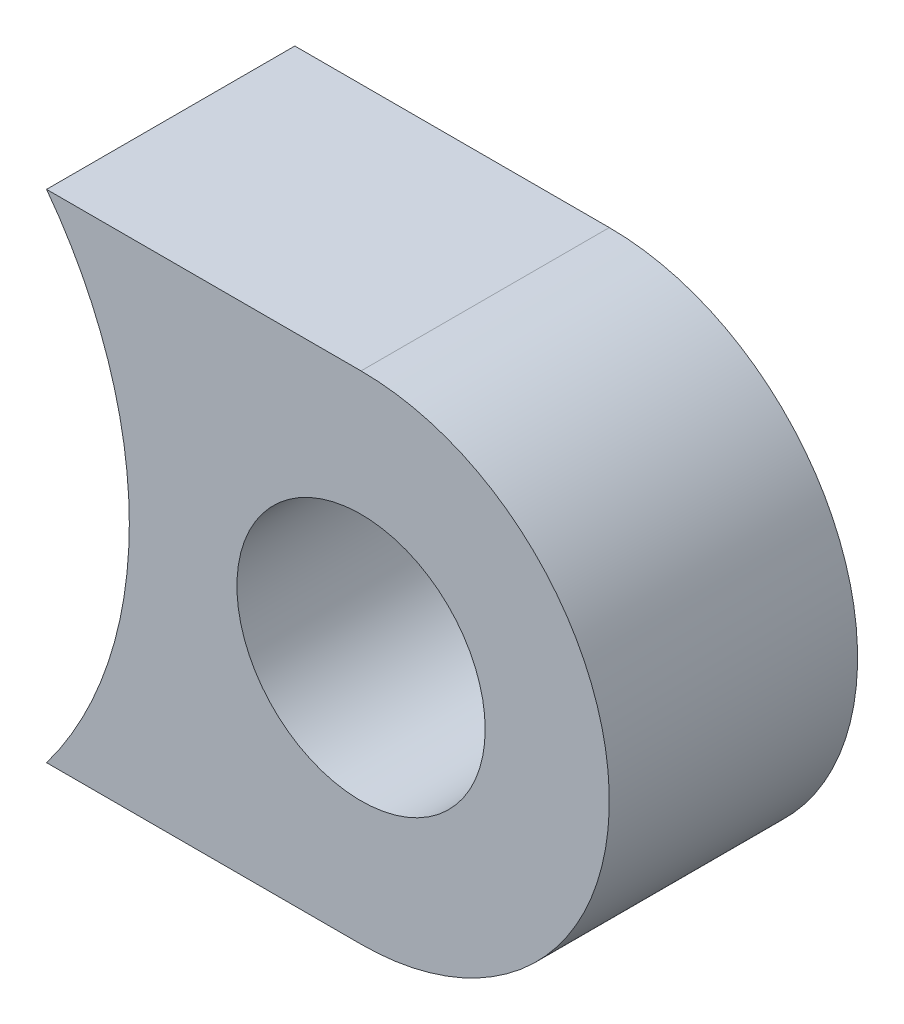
SolidWorks part; units mm, degrees
ref_plane "前视基准面" through (0, 0, 0) normal (0, 0, 1) x (1, 0, 0)
ref_plane "上视基准面" through (0, 0, 0) normal (0, 1, 0) x (1, 0, 0)
ref_plane "右视基准面" through (0, 0, 0) normal (1, 0, 0) x (0, 0, -1)
sketch "草图1" plane through (0, 0, 0) normal (0, 0, 1) x (1, 0, 0)
  line L0 (40, 30) -> (78, 30)
  line L1 (78, -30) -> (40, -30)
  line L2 (0, 0) -> (112.4023, 0) construction
  circle A0 centre (0, 0) radius 50
  arc A1 (78, 30) -> (78, -30) centre (78, 0) cw
  circle A2 centre (78, 0) radius 15
  dimension "D1" = 30
  dimension "D2" = 100
  dimension "D4" = 30
  dimension "D3" = 78
extrude "拉伸1" add sketch "草图1" along normal blind 30
